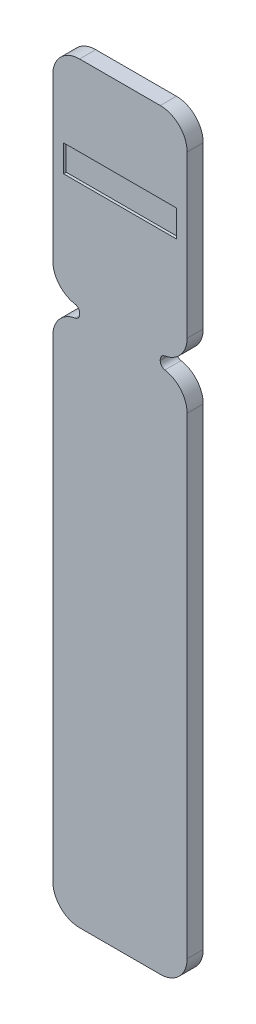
SolidWorks part; units mm, degrees
ref_plane "Plan de face" through (0, 0, 0) normal (0, 0, 1) x (1, 0, 0)
ref_plane "Plan de dessus" through (0, 0, 0) normal (0, 1, 0) x (1, 0, 0)
ref_plane "Plan de droite" through (0, 0, 0) normal (1, 0, 0) x (0, 0, -1)
sketch "Esquisse1" plane through (0, 0, 0) normal (0, 0, 1) x (1, 0, 0)
  line L0 (-50, 60) -> (-50, 20)
  line L1 (-50, 60) -> (-25, 60)
  line L2 (-50, 17.9) -> (-50, -80)
  line L3 (-50, -80) -> (-25, -80)
  line L4 (-25, 17.9) -> (-25, -80)
  line L5 (-50, 20) -> (-45, 20)
  line L6 (-25, 20) -> (-30, 20)
  line L7 (-50, 17.9) -> (-45, 17.9)
  line L8 (-45, 20) -> (-45, 17.9)
  line L9 (-30, 20) -> (-30, 17.9)
  line L10 (-30, 17.9) -> (-25, 17.9)
  line L11 (-25, 60) -> (-25, 20)
  dimension "D1" = 25
  dimension "D2" = 140
  dimension "D3" = 5
  dimension "D4" = 2.1
  dimension "D5" = 40
  dimension "D6" = 5
  dimension "D7" = 2.1
  dimension "D8" = 40
extrude "Extrusion1" add sketch "Esquisse1" along normal blind 3
fillet "Congé1" radius 5 12 edges at (-47.5, 20, 3) (-27.5, 20, 0) (-27.5, 17.9, 0) (-47.5, 17.9, 0) (-47.5, 20, 0) (-47.5, 17.9, 3) (-25, 20, 1.5) (-25, 17.9, 1.5) (-50, 17.9, 1.5) (-50, 20, 1.5) (-27.5, 17.9, 3) (-27.5, 20, 3)
fillet "Congé2" radius 1.05 4 edges at (-30, 20, 1.5) (-30, 17.9, 1.5) (-45, 17.9, 1.5) (-45, 20, 1.5)
fillet "Congé3" radius 5 4 edges at (-25, 60, 1.5) (-25, -80, 1.5) (-50, -80, 1.5) (-50, 60, 1.5)
sketch "Esquisse3" plane through (0, 0, 3) normal (0, 0, 1) x (1, 0, 0)
  line L0 (-25, -75) -> (-25, 12.9) construction
  line L1 (-48, 45) -> (-27, 45)
  line L2 (-48, 45) -> (-48, 40)
  line L3 (-48, 40) -> (-27, 40)
  line L4 (-27, 45) -> (-27, 40)
  line L5 (-50, 55) -> (-50, 25) construction
  line L6 (-30, 60) -> (-45, 60) construction
  dimension "D1" = 2
  dimension "D2" = 2
  dimension "D3" = 15
  dimension "D4" = 5
extrude "Enlèv. mat.-Extru.1" cut sketch "Esquisse3" against normal blind 0.5
